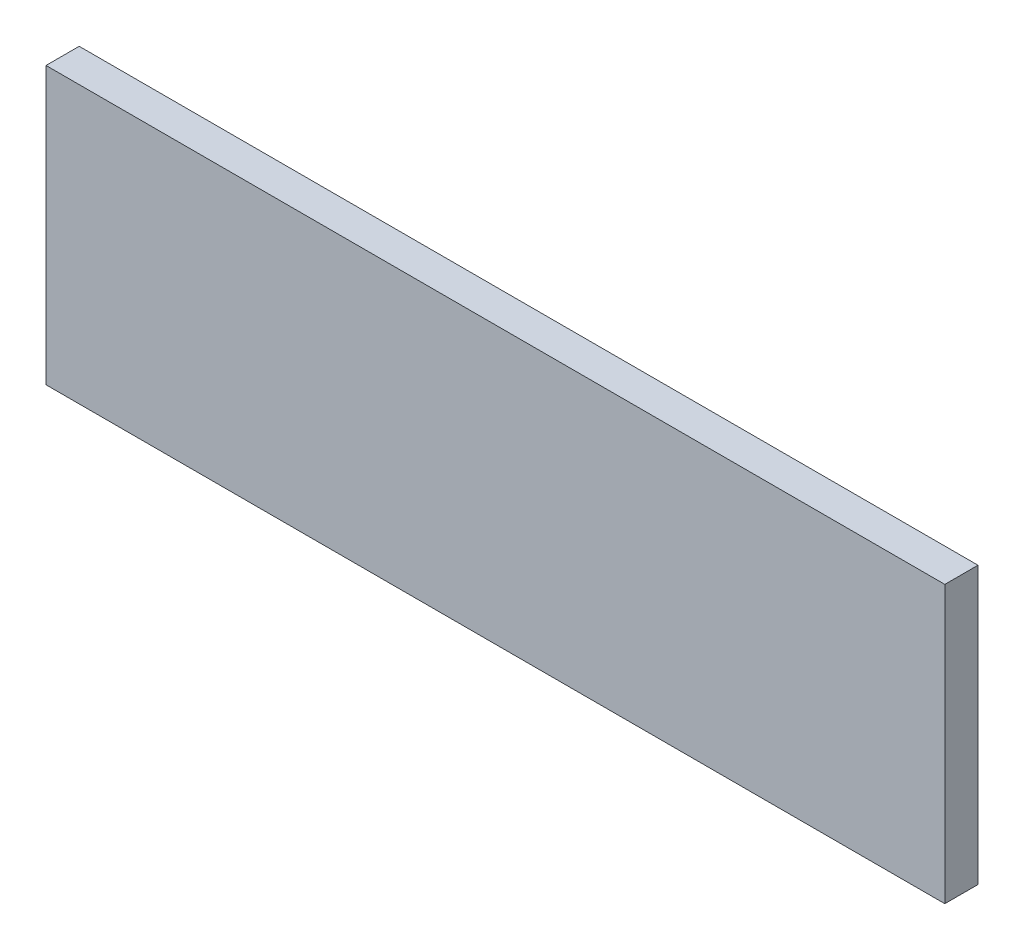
SolidWorks part; units mm, degrees
ref_plane "Face" through (0, 0, 0) normal (0, 0, 1) x (1, 0, 0)
ref_plane "Dessus" through (0, 0, 0) normal (0, 1, 0) x (1, 0, 0)
ref_plane "Droite" through (0, 0, 0) normal (1, 0, 0) x (0, 0, -1)
sketch "Esquisse1" plane through (0, 0, 0) normal (0, 0, 1) x (1, 0, 0)
  line L1 (0, 0) -> (325, 0)
  line L2 (0, 0) -> (0, -100)
  line L3 (0, -100) -> (325, -100)
  line L4 (325, 0) -> (325, -100)
  dimension "D1" = 325
  dimension "D2" = 100
extrude "Base-Extrusion" add sketch "Esquisse1" along normal blind 12
